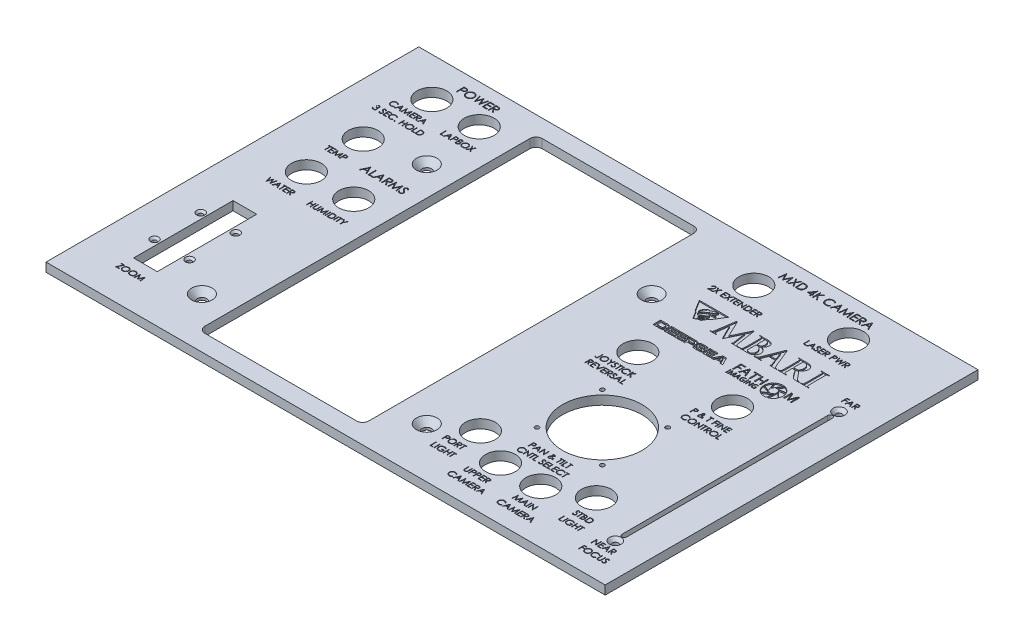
SolidWorks part; units mm, degrees
ref_plane "Front Plane" through (0, 0, 0) normal (0, 0, 1) x (1, 0, 0)
ref_plane "Top Plane" through (0, 0, 0) normal (0, 1, 0) x (1, 0, 0)
ref_plane "Right Plane" through (0, 0, 0) normal (1, 0, 0) x (0, 0, -1)
sketch "Sketch1" plane through (0, 0, 0) normal (0, 1, 0) x (1, 0, 0)
  line L0 (0, 99.9998) -> (0, -99.9998) construction
  line L1 (-149.9997, 99.9998) -> (149.9997, 99.9998)
  line L2 (-149.9997, 99.9998) -> (-149.9997, -99.9998)
  line L3 (-149.9997, -99.9998) -> (149.9997, -99.9998)
  line L4 (149.9997, 99.9998) -> (149.9997, -99.9998)
  line L5 (-149.9997, 99.9998) -> (149.9997, -99.9998) construction
  line L6 (-149.9997, -99.9998) -> (149.9997, 99.9998) construction
  point P0 (0, 0)
  dimension "D1" = 199.9996
  dimension "D2" = 299.9994
extrude "Boss-Extrude1" add sketch "Sketch1" along normal blind 4.7498
sketch "Sketch2" plane through (0, 4.7498, 0) normal (0, 1, 0) x (1, 0, 0)
  line L0 (-149.9997, -99.9998) -> (149.9997, -99.9998) construction
  line L1 (-128.4097, -21.2598) -> (-115.7097, -21.2598)
  line L2 (-128.4097, -21.2598) -> (-128.4097, -74.5998)
  line L3 (-128.4097, -74.5998) -> (-115.7097, -74.5998)
  line L4 (-115.7097, -21.2598) -> (-115.7097, -74.5998)
  line L5 (-74.3077, 90.4998) -> (7.0883, 90.4998)
  line L6 (-77.6097, 87.1978) -> (-77.6097, -87.1982)
  line L7 (-74.3077, -90.5002) -> (7.0883, -90.5002)
  line L8 (10.3903, 87.1978) -> (10.3903, -87.1982)
  line L10 (130.9497, 38.4302) -> (130.9497, -72.0598)
  line L12 (133.4897, 38.4302) -> (133.4897, -72.0598)
  line L13 (-149.9997, 99.9998) -> (-149.9997, -99.9998) construction
  line L14 (50.6603, 79.0702) -> (101.4603, 79.0702) construction
  line L15 (130.9497, 38.4302) -> (133.4897, 38.4302) construction
  line L16 (132.2197, 39.7002) -> (132.2197, 38.4302) construction
  line L17 (132.2197, -72.0598) -> (132.2197, -73.3298) construction
  line L18 (130.9497, -72.0598) -> (133.4897, -72.0598) construction
  line L19 (40.6475, -27.6098) -> (100.4241, -27.6098) construction
  line L20 (76.0603, 97.2552) -> (76.0603, -53.0551) construction
  line L21 (-122.0597, -74.5998) -> (-122.0597, 94.7152) construction
  line L22 (-122.0597, 11.7602) -> (-86.434, 11.7602) construction
  line L23 (50.6603, 16.8402) -> (50.6603, 79.0702) construction
  line L24 (101.4603, 16.8402) -> (101.4603, 79.0702) construction
  line L25 (50.6603, 16.8402) -> (101.4603, 16.8402) construction
  line L26 (-96.6597, -1.4419) -> (-96.6597, 89.1405) construction
  line L27 (-122.0597, 79.0702) -> (-82.6532, 79.0702) construction
  circle A0 centre (76.0603, -27.6098) radius 21.336
  arc A1 (133.4897, 38.4302) -> (130.9497, 38.4302) centre (132.2197, 38.4302) ccw
  arc A2 (130.9497, -72.0598) -> (133.4897, -72.0598) centre (132.2197, -72.0598) ccw
  circle A3 centre (86.8553, -71.4248) radius 8.001
  circle A4 centre (107.1753, -61.8998) radius 8.001
  circle A5 centre (-122.0597, 79.0702) radius 8.001
  circle A6 centre (-122.0597, 42.2402) radius 8.001
  circle A11 centre (101.4603, 16.8402) radius 8.001
  circle A12 centre (50.6603, 16.8402) radius 8.001
  circle A13 centre (50.6603, 79.0702) radius 8.001
  circle A14 centre (101.4603, 79.0702) radius 8.001
  circle A15 centre (-122.0597, 11.7602) radius 8.001
  arc A17 (7.0883, -90.5002) -> (10.3903, -87.1982) centre (7.0883, -87.1982) ccw
  arc A18 (-77.6097, -87.1982) -> (-74.3077, -90.5002) centre (-74.3077, -87.1982) ccw
  arc A19 (7.0883, 90.4998) -> (10.3903, 87.1978) centre (7.0883, 87.1978) cw
  arc A20 (-74.3077, 90.4998) -> (-77.6097, 87.1978) centre (-74.3077, 87.1978) ccw
  circle A21 centre (44.9453, -61.8998) radius 8.001
  circle A22 centre (65.2653, -71.4248) radius 8.001
  circle A23 centre (-96.6597, 11.7602) radius 8.001
  circle A24 centre (-96.6597, 79.0702) radius 8.001
  point P21 (132.2197, -72.6948)
  dimension "D10" = 42.672
  dimension "D13" = 1.27
  dimension "D14" = 1.27
  dimension "D18" = 43.815
  dimension "D20" = 16.002
  dimension "D23" = 16.002
  dimension "D40" = 3.302
  dimension "D48" = 16.002
  dimension "D49" = 16.002
  dimension "D50" = 16.002
  dimension "D51" = 16.002
  dimension "D52" = 16.002
  dimension "D53" = 16.002
  dimension "D54" = 16.002
  dimension "D27" = 16.002
  dimension "D28" = 16.002
  dimension "D1" = 25.4
  dimension "D2" = 21.59
  dimension "D3" = 12.7
  dimension "D4" = 53.34
  dimension "D5" = 181
  dimension "D6" = 88
  dimension "D7" = 9.4996
  dimension "D8" = 72.39
  dimension "D9" = 72.39
  dimension "D11" = 226.06
  dimension "D12" = 2.54
  dimension "D15" = 110.49
  dimension "D16" = 27.94
  dimension "D17" = 282.2194
  dimension "D19" = 10.795
  dimension "D21" = 31.115
  dimension "D22" = 34.29
  dimension "D24" = 116.84
  dimension "D25" = 62.23
  dimension "D26" = 53.34
  dimension "D41" = 111.76
  dimension "D42" = 142.24
  dimension "D43" = 179.07
  dimension "D44" = 25.4
  dimension "D45" = 25.4
extrude "Cut-Extrude1" cut sketch "Sketch2" against normal through all
sketch "Sketch3" plane through (0, 4.7498, 0) normal (0, 1, 0) x (1, 0, 0)
  line L0 (-134.4416, 65.1002) -> (136.4546, 65.1002) construction
  line L1 (-149.9997, -99.9998) -> (149.9997, -99.9998) construction
  line L2 (-141.2326, 27.0002) -> (138.1735, 27.0002) construction
  line L3 (-141.2326, -3.4798) -> (-97.0964, -3.4798) construction
  line L5 (40.7797, 3.1877) -> (120.5059, 3.1877) construction
  line L7 (37.7416, -75.8698) -> (106.4944, -75.8698) construction
  line L9 (55.5395, -84.7598) -> (81.8998, -84.7598) construction
  line L10 (149.9997, -99.9998) -> (149.9997, 99.9998) construction
  line L11 (120.5059, -2.2098) -> (31.7465, -2.2098) construction
  line L13 (40.7797, 3.1877) -> (40.7797, -2.2098) construction
  line L15 (91.8337, 3.1877) -> (91.8337, -2.2098) construction
  text T0 "JOYSTICK  "
  text T1 "HUMIDITY"
  text T2 "  CAMERA  3 SEC. HOLD"
  text T3 "ZOOM"
  text T4 "WATER"
  text T5 "TEMP"
  text T6 "2X EXTENDER"
  text T7 "LASER PWR"
  text T8 "P & T FINE"
  text T9 "FOCUS"
  text T10 "NEAR"
  text T11 "FAR"
  text T12 " STBD  LIGHT"
  text T13 "  MAIN  CAMERA"
  text T14 "  UPPER  CAMERA"
  text T15 "PORT  LIGHT"
  text T16 "PAN & TILT"
  text T17 "MXD 4K CAMERA" font "Century Gothic" height in points 16
  text T18 "ALARMS" font "Century Gothic" height in points 16
  text T19 "LAPBOX"
  text T20 "POWER" font "Century Gothic" height in points 16
  text T21 "REVERSAL"
  text T22 "CONTROL"
  text T23 "CNTL SELECT"
  dimension "D1" = 165.1
  dimension "D2" = 127
  dimension "D3" = 103.1875
  dimension "D4" = 24.13
  dimension "D5" = 15.24
  dimension "D6" = 96.52
  dimension "D7" = 189.23
  dimension "D8" = 43.815
  dimension "D9" = 85.725
  dimension "D10" = 97.79
  dimension "D11" = 38.735
  dimension "D12" = 86.995
  dimension "D13" = 109.22
  dimension "D14" = 58.166
  dimension "D15" = 16.51
extrude "Cut-Extrude2" cut sketch "Sketch3" against normal blind 0.635
hole_wizard "CSK for #10 Flat Head Machine Screw1" positions "Sketch4" profile "Sketch5" countersink size "#10" standard "ANSI Inch"
sketch "Sketch4" plane through (0, 4.7498, 0) normal (0, 1, 0) x (1, 0, 0)
  point P0 (-93.345, 47.625)
  point P3 (-93.345, -73.025)
  point P6 (27.305, -73.025)
  point P9 (27.305, 47.625)
sketch "Sketch5" plane through (-93.345, 4.7498, -47.625) normal (1, 0, 0) x (0, 0, 1)
  line L0 (0, 0) -> (0, 4.7498)
  line L1 (0, 4.7498) -> (2.5527, 4.7498)
  line L2 (2.5527, 4.7498) -> (2.5527, 3.4187)
  line L3 (2.5527, 3.4187) -> (5.5245, 0)
  line L5 (5.5245, 0) -> (0, 0)
  line L6 (-2.5527, 3.4187) -> (-5.5245, 0) construction
  line L11 (0, -6.35) -> (0, 107.95) construction
  dimension "Thru Hole Dia." = 5.1054
  dimension "Thru Hole Depth" = 4.7498
  dimension "Near C'Sink Dia." = 11.049
  dimension "Near C'Sink Angle" = 82
hole_wizard "CSK for #2 Flat Head Machine Screw1" positions "Sketch6" profile "Sketch7" countersink size "#2" standard "ANSI Inch"
sketch "Sketch6" plane through (0, 4.7498, 0) normal (0, 1, 0) x (1, 0, 0)
  line L0 (-131.4577, -35.5346) -> (-131.4577, -60.325) construction
  line L1 (-131.4577, -60.325) -> (-112.6617, -60.325) construction
  line L2 (-112.6617, -60.325) -> (-112.6617, -35.5346) construction
  line L3 (-112.6617, -35.5346) -> (-131.4577, -35.5346) construction
  line L5 (-122.0597, -21.2598) -> (-122.0597, -74.5998) construction
  line L6 (-115.7097, -21.2598) -> (-128.4097, -21.2598) construction
  line L7 (-128.4097, -74.5998) -> (-115.7097, -74.5998) construction
  line L9 (-128.4097, -47.9298) -> (-115.7097, -47.9298) construction
  line L10 (-128.4097, -21.2598) -> (-128.4097, -74.5998) construction
  line L11 (-115.7097, -74.5998) -> (-115.7097, -21.2598) construction
  point P0 (-131.4577, -35.5346)
  point P2 (-112.6617, -35.5346)
  point P4 (-112.6617, -60.325)
  point P6 (-131.4577, -60.325)
  dimension "D1" = 9.398
  dimension "D2" = 18.796
  dimension "D3" = 12.3952
  dimension "D4" = 24.7904
sketch "Sketch7" plane through (-131.4577, 4.7498, 35.5346) normal (1, 0, 0) x (0, 0, 1)
  line L0 (0, 0) -> (0, 4.7498)
  line L1 (0, 4.7498) -> (1.2192, 4.7498)
  line L2 (1.2192, 4.7498) -> (1.2192, 1.1103)
  line L3 (1.2192, 1.1103) -> (2.1844, 0)
  line L5 (2.1844, 0) -> (0, 0)
  line L6 (-1.2192, 1.1103) -> (-2.1844, 0) construction
  line L11 (0, -6.35) -> (0, 107.95) construction
  dimension "Thru Hole Dia." = 2.4384
  dimension "Thru Hole Depth" = 4.7498
  dimension "Near C'Sink Dia." = 4.3688
  dimension "Near C'Sink Angle" = 82
hole_wizard "#4-40 Tapped Hole1" positions "Sketch8" profile "Sketch9" tap size "#4-40" standard "ANSI Inch"
sketch "Sketch8" plane through (0, 4.7498, 0) normal (0, 1, 0) x (1, 0, 0)
  line L0 (58.5343, -10.0838) -> (93.5863, -10.0838) construction
  line L1 (93.5863, -10.0838) -> (93.5863, -45.1358) construction
  line L2 (93.5863, -45.1358) -> (58.5343, -45.1358) construction
  line L3 (58.5343, -45.1358) -> (58.5343, -10.0838) construction
  line L5 (54.7243, -27.6098) -> (97.3963, -27.6098) construction
  line L7 (76.0603, -6.2738) -> (76.0603, -48.9458) construction
  circle A0 centre (76.0603, -27.6098) radius 21.336 construction
  point P0 (58.5343, -10.0838)
  point P2 (93.5863, -10.0838)
  point P4 (93.5863, -45.1358)
  point P6 (58.5343, -45.1358)
  dimension "D1" = 17.526
  dimension "D2" = 35.052
  dimension "D3" = 17.526
  dimension "D4" = 35.052
sketch "Sketch9" plane through (58.5343, 4.7498, 10.0838) normal (1, 0, 0) x (0, 0, 1)
  line L0 (0, 0) -> (0, 4.7498)
  line L1 (0, 4.7498) -> (1.1303, 4.7498)
  line L2 (1.1303, 4.7498) -> (1.1303, 0)
  line L5 (1.1303, 0) -> (0, 0)
  line L11 (0, -6.35) -> (0, 107.95) construction
  dimension "Thread Major Dia." = 2.2606
  dimension "Thru Tap Drill Depth" = 4.7498
hole_wizard "CSK for #4 Flat Head Machine Screw1" positions "Sketch10" profile "Sketch11" countersink size "#4" standard "ANSI Inch"
sketch "Sketch10" plane through (0, 4.7498, 0) normal (0, 1, 0) x (1, 0, 0)
  line L1 (132.2197, 41.692) -> (132.2197, -88.1599) construction
  line L3 (130.9497, -16.8148) -> (133.4897, -16.8148) construction
  line L5 (133.4897, -72.0598) -> (133.4897, 38.4302) construction
  line L6 (130.9497, 38.4302) -> (130.9497, -72.0598) construction
  point P0 (132.2197, 43.1852)
  point P2 (132.2197, -76.8148)
  dimension "D1" = 120
  dimension "D2" = 60
sketch "Sketch11" plane through (132.2197, 4.7498, -43.1852) normal (1, 0, 0) x (0, 0, 1)
  line L0 (0, 0) -> (0, 4.7498)
  line L1 (0, 4.7498) -> (1.6319, 4.7498)
  line L2 (1.6319, 4.7498) -> (1.6319, 1.7751)
  line L3 (1.6319, 1.7751) -> (3.175, 0)
  line L5 (3.175, 0) -> (0, 0)
  line L6 (-1.632, 1.7751) -> (-3.175, 0) construction
  line L11 (0, -6.35) -> (0, 107.95) construction
  dimension "Thru Hole Dia." = 3.2639
  dimension "Thru Hole Depth" = 4.7498
  dimension "Near C'Sink Dia." = 6.35
  dimension "Near C'Sink Angle" = 82
sketch "Sketch12" plane through (0, 4.7498, 0) normal (0, 1, 0) x (1, 0, 0)
  line L0 (63.3963, 57.2737) -> (67.4901, 48.8157)
  line L1 (67.4901, 48.8157) -> (71.5692, 57.3786)
  line L2 (72.1691, 57.2737) -> (73.5339, 48.0058)
  line L3 (71.8089, 47.1363) -> (70.9091, 53.7348)
  line L4 (70.9091, 53.7348) -> (70.849, 53.7348)
  line L5 (70.849, 53.7348) -> (67.5799, 46.9263)
  line L6 (63.216, 53.5696) -> (63.1562, 53.5696)
  line L7 (63.1562, 53.5696) -> (62.3763, 47.6013)
  line L8 (61.2517, 47.5714) -> (62.7364, 57.3485)
  line L9 (78.9197, 51.875) -> (78.9197, 48.3209)
  line L10 (87.6056, 49.8652) -> (86.7955, 47.7209)
  line L11 (87.1705, 46.3411) -> (87.3954, 46.3411)
  line L12 (85.6407, 47.7209) -> (89.4049, 57.1385)
  line L13 (92.4347, 46.7009) -> (91.235, 49.8801)
  line L14 (90.8745, 50.8252) -> (89.5251, 54.5291)
  line L15 (89.3601, 54.5291) -> (87.9801, 50.8403)
  line L16 (107.7837, 46.0713) -> (106.3589, 46.0713)
  line L17 (100.9451, 50.7352) -> (99.6405, 50.7651)
  line L18 (99.5203, 50.6451) -> (99.5203, 50.4351)
  line L19 (111.7344, 53.0598) -> (111.7344, 50.4205)
  line L20 (52.6101, 54.0346) -> (52.6039, 53.9861)
  line L21 (53.9713, 55.9958) -> (54.0382, 55.9587)
  line L256 (43.0063, 57.5156) -> (46.7871, 51.3878)
  line L257 (46.7871, 51.3878) -> (47.2165, 51.3878)
  line L258 (47.2165, 51.3878) -> (50.8633, 45.4987)
  line L259 (50.8633, 45.4987) -> (54.5059, 51.3878)
  line L260 (54.5059, 51.3878) -> (54.9489, 51.3878)
  line L261 (54.9489, 51.3878) -> (58.7301, 57.5156)
  line L262 (58.7301, 57.5156) -> (43.0063, 57.5156)
  line L263 (54.3276, 56.3331) -> (54.2625, 56.2405)
  line L264 (51.0648, 54.2538) -> (50.6373, 53.9216)
  line L265 (52.8742, 54.6344) -> (52.5961, 54.7167)
  line L266 (50.3806, 48.0414) -> (50.988, 48.7734)
  line L267 (51.1383, 54.191) -> (51.3163, 54.2821)
  line L268 (52.8101, 54.5419) -> (54.6636, 54.3981)
  line L269 (54.734, 54.5113) -> (54.8182, 54.4159)
  spline S0 degree 3 poles (62.7364, 57.3485) (62.7812, 57.6035) (62.8712, 57.7385) (62.9912, 57.7385) knots 0 0 0 0 1 1 1 1
  spline S1 degree 3 poles (62.9912, 57.7385) (63.1111, 57.7385) (63.201, 57.6636) (63.3963, 57.2737) knots 1 1 1 1 2 2 2 2
  spline S2 degree 3 poles (71.5692, 57.3786) (71.6743, 57.6186) (71.7641, 57.7385) (71.899, 57.7385) knots 4 4 4 4 5 5 5 5
  spline S3 degree 3 poles (71.899, 57.7385) (72.034, 57.7385) (72.1238, 57.5884) (72.1691, 57.2737) knots 5 5 5 5 6 6 6 6
  spline S4 degree 3 poles (73.5339, 48.0058) (73.6688, 47.0612) (73.8185, 46.6261) (74.2686, 46.4911) knots 7 7 7 7 8 8 8 8
  spline S5 degree 3 poles (74.2686, 46.4911) (74.7033, 46.3562) (75.0033, 46.3414) (75.1982, 46.3414) knots 8 8 8 8 9 9 9 9
  spline S6 degree 3 poles (75.1982, 46.3414) (75.3335, 46.3414) (75.4381, 46.3263) (75.4381, 46.2363) knots 9 9 9 9 10 10 10 10
  spline S7 degree 3 poles (75.4381, 46.2363) (75.4381, 46.1163) (75.2585, 46.0713) (75.0483, 46.0713) knots 10 10 10 10 11 11 11 11
  spline S8 degree 3 poles (75.0483, 46.0713) (74.6735, 46.0713) (72.6037, 46.1163) (72.0039, 46.1615) knots 11 11 11 11 12 12 12 12
  spline S9 degree 3 poles (72.0039, 46.1615) (71.659, 46.1912) (71.569, 46.2363) (71.569, 46.3263) knots 12 12 12 12 13 13 13 13
  spline S10 degree 3 poles (71.569, 46.3263) (71.569, 46.4014) (71.6289, 46.4465) (71.7342, 46.4913) knots 13 13 13 13 14 14 14 14
  spline S11 degree 3 poles (71.7342, 46.4913) (71.8238, 46.5216) (71.869, 46.7163) (71.8089, 47.1363) knots 14 14 14 14 15 15 15 15
  spline S12 degree 3 poles (67.5799, 46.9263) (67.2351, 46.2216) (67.1599, 46.0866) (67.0249, 46.0866) knots 18 18 18 18 19 19 19 19
  spline S13 degree 3 poles (67.0249, 46.0866) (66.89, 46.0866) (66.7399, 46.3866) (66.5002, 46.8363) knots 19 19 19 19 20 20 20 20
  spline S14 degree 3 poles (66.5002, 46.8363) (66.1403, 47.5262) (64.9557, 49.8209) (64.7758, 50.2406) knots 20 20 20 20 21 21 21 21
  spline S15 degree 3 poles (64.7758, 50.2406) (64.6406, 50.5553) (63.7409, 52.4451) (63.216, 53.5696) knots 21 21 21 21 22 22 22 22
  spline S16 degree 3 poles (62.3763, 47.6013) (62.3461, 47.3312) (62.3312, 47.1363) (62.3312, 46.8964) knots 24 24 24 24 25 25 25 25
  spline S17 degree 3 poles (62.3312, 46.8964) (62.3312, 46.6114) (62.526, 46.4764) (62.7812, 46.4165) knots 25 25 25 25 26 26 26 26
  spline S18 degree 3 poles (62.7812, 46.4165) (63.0513, 46.3566) (63.261, 46.3418) (63.411, 46.3418) knots 26 26 26 26 27 27 27 27
  spline S19 degree 3 poles (63.411, 46.3418) (63.5309, 46.3418) (63.636, 46.3116) (63.636, 46.2367) knots 27 27 27 27 28 28 28 28
  spline S20 degree 3 poles (63.636, 46.2367) (63.636, 46.1018) (63.5008, 46.0717) (63.2761, 46.0717) knots 28 28 28 28 29 29 29 29
  spline S21 degree 3 poles (63.2761, 46.0717) (62.6461, 46.0717) (61.9713, 46.1167) (61.7015, 46.1167) knots 29 29 29 29 30 30 30 30
  spline S22 degree 3 poles (61.7015, 46.1167) (61.4167, 46.1167) (60.6969, 46.0717) (60.217, 46.0717) knots 30 30 30 30 31 31 31 31
  spline S23 degree 3 poles (60.217, 46.0717) (60.0669, 46.0717) (59.9468, 46.1018) (59.9468, 46.2367) knots 31 31 31 31 32 32 32 32
  spline S24 degree 3 poles (59.9468, 46.2367) (59.9468, 46.3116) (60.037, 46.3418) (60.1867, 46.3418) knots 32 32 32 32 33 33 33 33
  spline S25 degree 3 poles (60.1867, 46.3418) (60.3067, 46.3418) (60.4118, 46.3418) (60.6368, 46.3868) knots 33 33 33 33 34 34 34 34
  spline S26 degree 3 poles (60.6368, 46.3868) (61.0566, 46.4766) (61.1768, 47.0618) (61.2517, 47.5714) knots 34 34 34 34 35 35 35 35
  spline S28 degree 3 poles (77.0901, 56.239) (77.0601, 56.7487) (76.9401, 56.9888) (76.4452, 57.0937) knots 1 1 1 1 2 2 2 2
  spline S29 degree 3 poles (76.4452, 57.0937) (76.3252, 57.1238) (76.07, 57.1387) (75.8602, 57.1387) knots 2 2 2 2 3 3 3 3
  spline S30 degree 3 poles (75.8602, 57.1387) (75.6952, 57.1387) (75.6056, 57.1684) (75.6056, 57.2737) knots 3 3 3 3 4 4 4 4
  spline S31 degree 3 poles (75.6056, 57.2737) (75.6056, 57.3786) (75.7103, 57.4086) (75.9352, 57.4086) knots 4 4 4 4 5 5 5 5
  spline S32 degree 3 poles (75.9352, 57.4086) (76.7301, 57.4086) (77.675, 57.3638) (77.9746, 57.3638) knots 5 5 5 5 6 6 6 6
  spline S33 degree 3 poles (77.9746, 57.3638) (78.7097, 57.3638) (79.2945, 57.4086) (79.8045, 57.4086) knots 6 6 6 6 7 7 7 7
  spline S34 degree 3 poles (79.8045, 57.4086) (82.5186, 57.4086) (82.9986, 55.9541) (82.9986, 55.1593) knots 7 7 7 7 8 8 8 8
  spline S35 degree 3 poles (82.9986, 55.1593) (82.9986, 53.9293) (82.2937, 53.1946) (81.469, 52.5347) knots 8 8 8 8 9 9 9 9
  spline S36 degree 3 poles (81.469, 52.5347) (82.6988, 52.1149) (84.1983, 51.0498) (84.1983, 49.2953) knots 9 9 9 9 10 10 10 10
  spline S37 degree 3 poles (84.1983, 49.2953) (84.1983, 47.6907) (82.9536, 46.0263) (80.1942, 46.0263) knots 10 10 10 10 11 11 11 11
  spline S38 degree 3 poles (80.1942, 46.0263) (79.8342, 46.0263) (78.4698, 46.1163) (78.0199, 46.1163) knots 11 11 11 11 12 12 12 12
  spline S39 degree 3 poles (78.0199, 46.1163) (77.6748, 46.1163) (76.7299, 46.0713) (76.1303, 46.0713) knots 12 12 12 12 13 13 13 13
  spline S40 degree 3 poles (76.1303, 46.0713) (75.9352, 46.0713) (75.8303, 46.1163) (75.8303, 46.2214) knots 13 13 13 13 14 14 14 14
  spline S41 degree 3 poles (75.8303, 46.2214) (75.8303, 46.2961) (75.8906, 46.3414) (76.0702, 46.3414) knots 14 14 14 14 15 15 15 15
  spline S42 degree 3 poles (76.0702, 46.3414) (76.2953, 46.3414) (76.4751, 46.3713) (76.6102, 46.4014) knots 15 15 15 15 16 16 16 16
  spline S43 degree 3 poles (76.6102, 46.4014) (76.91, 46.4615) (76.9854, 46.7911) (77.045, 47.2259) knots 16 16 16 16 17 17 17 17
  spline S44 degree 3 poles (77.045, 47.2259) (77.2231, 49.0065) (77.1617, 52.3479) (77.0901, 56.239) knots 17 17 17 17 18 18 18 18
  spline S46 degree 3 poles (78.9197, 52.8048) (78.9197, 52.6848) (78.9647, 52.6547) (79.0248, 52.64) knots 0 0 0 0 1 1 1 1
  spline S47 degree 3 poles (79.0248, 52.64) (79.1597, 52.6096) (79.3847, 52.5948) (79.7293, 52.5948) knots 1 1 1 1 2 2 2 2
  spline S48 degree 3 poles (79.7293, 52.5948) (80.2245, 52.5948) (80.554, 52.6549) (80.8093, 52.8799) knots 2 2 2 2 3 3 3 3
  spline S49 degree 3 poles (80.8093, 52.8799) (81.1991, 53.1946) (81.4244, 53.7348) (81.4244, 54.4695) knots 3 3 3 3 4 4 4 4
  spline S50 degree 3 poles (81.4244, 54.4695) (81.4244, 55.4742) (80.8394, 56.7941) (79.5497, 56.7941) knots 4 4 4 4 5 5 5 5
  spline S51 degree 3 poles (79.5497, 56.7941) (79.3397, 56.7941) (79.2049, 56.7941) (79.0548, 56.7639) knots 5 5 5 5 6 6 6 6
  spline S52 degree 3 poles (79.0548, 56.7639) (78.9499, 56.7338) (78.9197, 56.6741) (78.9197, 56.5089) knots 6 6 6 6 7 7 7 7
  spline S53 degree 2 poles (78.9197, 56.5089) (78.9197, 52.8048) (78.9197, 52.8048) knots 7 7 7 8 8 8
  spline S54 degree 3 poles (80.8993, 51.6051) (80.5844, 51.83) (80.2396, 51.9348) (79.6546, 51.965) knots 0 0 0 0 1 1 1 1
  spline S55 degree 3 poles (79.6546, 51.965) (79.3847, 51.9801) (79.2346, 51.9801) (79.0098, 51.9801) knots 1 1 1 1 2 2 2 2
  spline S56 degree 3 poles (79.0098, 51.9801) (78.9497, 51.9801) (78.9197, 51.9497) (78.9197, 51.875) knots 2 2 2 2 3 3 3 3
  spline S57 degree 3 poles (78.9197, 48.3209) (78.9197, 47.331) (78.9647, 47.0762) (79.4448, 46.8813) knots 4 4 4 4 5 5 5 5
  spline S58 degree 3 poles (79.4448, 46.8813) (79.8497, 46.7163) (80.1944, 46.7015) (80.5394, 46.7015) knots 5 5 5 5 6 6 6 6
  spline S59 degree 3 poles (80.5394, 46.7015) (81.2144, 46.7015) (82.354, 47.0614) (82.354, 48.6209) knots 6 6 6 6 7 7 7 7
  spline S60 degree 3 poles (82.354, 48.6209) (82.3538, 49.5503) (82.0391, 50.8099) (80.8993, 51.6051) knots 7 7 7 7 8 8 8 8
  spline S61 degree 3 poles (87.7404, 49.9852) (87.6655, 49.9852) (87.6351, 49.9553) (87.6056, 49.8652) knots 0 0 0 0 1 1 1 1
  spline S62 degree 3 poles (86.7955, 47.7209) (86.6458, 47.3457) (86.5711, 46.9858) (86.5711, 46.8059) knots 2 2 2 2 3 3 3 3
  spline S63 degree 3 poles (86.5711, 46.8059) (86.5711, 46.5359) (86.7057, 46.3411) (87.1705, 46.3411) knots 3 3 3 3 4 4 4 4
  spline S64 degree 3 poles (87.3954, 46.3411) (87.5752, 46.3411) (87.6205, 46.311) (87.6205, 46.2212) knots 5 5 5 5 6 6 6 6
  spline S65 degree 3 poles (87.6205, 46.2212) (87.6205, 46.1012) (87.5306, 46.0711) (87.3654, 46.0711) knots 6 6 6 6 7 7 7 7
  spline S66 degree 3 poles (87.3654, 46.0711) (86.8858, 46.0711) (86.2405, 46.1161) (85.7755, 46.1161) knots 7 7 7 7 8 8 8 8
  spline S67 degree 3 poles (85.7755, 46.1161) (85.6107, 46.1161) (84.7858, 46.0711) (84.0061, 46.0711) knots 8 8 8 8 9 9 9 9
  spline S68 degree 3 poles (84.0061, 46.0711) (83.811, 46.0711) (83.7212, 46.1012) (83.7212, 46.2212) knots 9 9 9 9 10 10 10 10
  spline S69 degree 3 poles (83.7212, 46.2212) (83.7212, 46.311) (83.7813, 46.3411) (83.9012, 46.3411) knots 10 10 10 10 11 11 11 11
  spline S70 degree 3 poles (83.9012, 46.3411) (84.0361, 46.3411) (84.2461, 46.356) (84.3662, 46.3711) knots 11 11 11 11 12 12 12 12
  spline S71 degree 3 poles (84.3662, 46.3711) (85.0559, 46.4613) (85.3409, 46.9709) (85.6407, 47.7209) knots 12 12 12 12 13 13 13 13
  spline S72 degree 3 poles (89.4049, 57.1385) (89.5852, 57.5733) (89.675, 57.7383) (89.8251, 57.7383) knots 14 14 14 14 15 15 15 15
  spline S73 degree 3 poles (89.8251, 57.7383) (89.9599, 57.7383) (90.0502, 57.6033) (90.1999, 57.2585) knots 15 15 15 15 16 16 16 16
  spline S74 degree 3 poles (90.1999, 57.2585) (90.56, 56.4335) (92.9591, 50.315) (93.9191, 48.0354) knots 16 16 16 16 17 17 17 17
  spline S75 degree 3 poles (93.9191, 48.0354) (94.4894, 46.686) (94.9239, 46.4758) (95.2388, 46.401) knots 17 17 17 17 18 18 18 18
  spline S76 degree 3 poles (95.2388, 46.401) (95.4638, 46.356) (95.6887, 46.3409) (95.8683, 46.3409) knots 18 18 18 18 19 19 19 19
  spline S77 degree 3 poles (95.8683, 46.3409) (95.9883, 46.3409) (96.0637, 46.3259) (96.0637, 46.221) knots 19 19 19 19 20 20 20 20
  spline S78 degree 3 poles (96.0637, 46.221) (96.0637, 46.101) (95.929, 46.0709) (95.3738, 46.0709) knots 20 20 20 20 21 21 21 21
  spline S79 degree 3 poles (95.3738, 46.0709) (94.8336, 46.0709) (93.739, 46.0709) (92.5398, 46.101) knots 21 21 21 21 22 22 22 22
  spline S80 degree 3 poles (92.5398, 46.101) (92.2693, 46.1159) (92.0899, 46.1159) (92.0899, 46.221) knots 22 22 22 22 23 23 23 23
  spline S81 degree 3 poles (92.0899, 46.221) (92.0899, 46.3108) (92.1493, 46.3409) (92.2996, 46.3558) knots 23 23 23 23 24 24 24 24
  spline S82 degree 3 poles (92.2996, 46.3558) (92.4048, 46.386) (92.5096, 46.521) (92.4347, 46.7009) knots 24 24 24 24 25 25 25 25
  spline S83 degree 3 poles (91.235, 49.8801) (91.2051, 49.9549) (91.1605, 49.9848) (91.0853, 49.9848) knots 26 26 26 26 27 27 27 27
  spline S84 degree 2 poles (91.0853, 49.9848) (87.7404, 49.9848) (87.7404, 49.9852) knots 27 27 27 28 28 28
  spline S85 degree 3 poles (90.7995, 50.7352) (90.8745, 50.7352) (90.8902, 50.7804) (90.8745, 50.8252) knots 0 0 0 0 1 1 1 1
  spline S86 degree 3 poles (89.5251, 54.5291) (89.5098, 54.5892) (89.4947, 54.6644) (89.4503, 54.6644) knots 2 2 2 2 3 3 3 3
  spline S87 degree 3 poles (89.4503, 54.6644) (89.4049, 54.6644) (89.3752, 54.5894) (89.3601, 54.5291) knots 3 3 3 3 4 4 4 4
  spline S88 degree 3 poles (87.9801, 50.8403) (87.9655, 50.7804) (87.9801, 50.7354) (88.0402, 50.7354) knots 5 5 5 5 6 6 6 6
  spline S89 degree 2 poles (88.0402, 50.7354) (90.7995, 50.7354) (90.7995, 50.7352) knots 6 6 6 7 7 7
  spline S90 degree 3 poles (97.7505, 53.0598) (97.7505, 55.3392) (97.7505, 55.759) (97.721, 56.239) knots 0 0 0 0 1 1 1 1
  spline S91 degree 3 poles (97.721, 56.239) (97.6911, 56.7487) (97.5711, 56.9888) (97.0759, 57.0937) knots 1 1 1 1 2 2 2 2
  spline S92 degree 3 poles (97.0759, 57.0937) (96.956, 57.1238) (96.701, 57.1387) (96.4914, 57.1387) knots 2 2 2 2 3 3 3 3
  spline S93 degree 3 poles (96.4914, 57.1387) (96.3264, 57.1387) (96.236, 57.1684) (96.236, 57.2737) knots 3 3 3 3 4 4 4 4
  spline S94 degree 3 poles (96.236, 57.2737) (96.236, 57.3786) (96.3413, 57.4086) (96.5661, 57.4086) knots 4 4 4 4 5 5 5 5
  spline S95 degree 3 poles (96.5661, 57.4086) (97.3609, 57.4086) (98.3058, 57.3638) (98.6205, 57.3638) knots 5 5 5 5 6 6 6 6
  spline S96 degree 3 poles (98.6205, 57.3638) (99.1309, 57.3638) (100.2699, 57.4086) (100.7351, 57.4086) knots 6 6 6 6 7 7 7 7
  spline S97 degree 3 poles (100.7351, 57.4086) (101.6802, 57.4086) (102.6849, 57.3188) (103.4948, 56.7637) knots 7 7 7 7 8 8 8 8
  spline S98 degree 3 poles (103.4948, 56.7637) (103.9143, 56.4788) (104.5142, 55.7139) (104.5142, 54.7092) knots 8 8 8 8 9 9 9 9
  spline S99 degree 3 poles (104.5142, 54.7092) (104.5142, 53.5997) (104.0498, 52.5799) (102.5348, 51.3501) knots 9 9 9 9 10 10 10 10
  spline S100 degree 3 poles (102.5348, 51.3501) (103.8695, 49.6705) (104.9044, 48.336) (105.7888, 47.4062) knots 10 10 10 10 11 11 11 11
  spline S101 degree 3 poles (105.7888, 47.4062) (106.6288, 46.5363) (107.2439, 46.4312) (107.4686, 46.3864) knots 11 11 11 11 12 12 12 12
  spline S102 degree 3 poles (107.4686, 46.3864) (107.6334, 46.3562) (107.7688, 46.3414) (107.8886, 46.3414) knots 12 12 12 12 13 13 13 13
  spline S103 degree 3 poles (107.8886, 46.3414) (108.0087, 46.3414) (108.0682, 46.2963) (108.0682, 46.2214) knots 13 13 13 13 14 14 14 14
  spline S104 degree 3 poles (108.0682, 46.2214) (108.0682, 46.1014) (107.9635, 46.0713) (107.7837, 46.0713) knots 14 14 14 14 15 15 15 15
  spline S105 degree 3 poles (106.3589, 46.0713) (105.5191, 46.0713) (105.1442, 46.1464) (104.7541, 46.3562) knots 16 16 16 16 17 17 17 17
  spline S106 degree 3 poles (104.7541, 46.3562) (104.1091, 46.7013) (103.5394, 47.406) (102.6996, 48.5609) knots 17 17 17 17 18 18 18 18
  spline S107 degree 3 poles (102.6996, 48.5609) (102.0999, 49.3856) (101.4101, 50.4052) (101.215, 50.6301) knots 18 18 18 18 19 19 19 19
  spline S108 degree 3 poles (101.215, 50.6301) (101.14, 50.7203) (101.0504, 50.7352) (100.9451, 50.7352) knots 19 19 19 19 20 20 20 20
  spline S109 degree 3 poles (99.6405, 50.7651) (99.5658, 50.7651) (99.5203, 50.7352) (99.5203, 50.6451) knots 21 21 21 21 22 22 22 22
  spline S110 degree 3 poles (99.5203, 50.4351) (99.5203, 49.0405) (99.5203, 47.8557) (99.5955, 47.2257) knots 23 23 23 23 24 24 24 24
  spline S111 degree 3 poles (99.5955, 47.2257) (99.6405, 46.7909) (99.7307, 46.4611) (100.1803, 46.4012) knots 24 24 24 24 25 25 25 25
  spline S112 degree 3 poles (100.1803, 46.4012) (100.4053, 46.3711) (100.7349, 46.3412) (100.9151, 46.3412) knots 25 25 25 25 26 26 26 26
  spline S113 degree 3 poles (100.9151, 46.3412) (101.0349, 46.3412) (101.0948, 46.2961) (101.0948, 46.2212) knots 26 26 26 26 27 27 27 27
  spline S114 degree 3 poles (101.0948, 46.2212) (101.0948, 46.1161) (100.9899, 46.0711) (100.795, 46.0711) knots 27 27 27 27 28 28 28 28
  spline S115 degree 3 poles (100.795, 46.0711) (99.9255, 46.0711) (98.8152, 46.1161) (98.5903, 46.1161) knots 28 28 28 28 29 29 29 29
  spline S116 degree 3 poles (98.5903, 46.1161) (98.3058, 46.1161) (97.3609, 46.0711) (96.7611, 46.0711) knots 29 29 29 29 30 30 30 30
  spline S117 degree 3 poles (96.7611, 46.0711) (96.5661, 46.0711) (96.4608, 46.1161) (96.4608, 46.2212) knots 30 30 30 30 31 31 31 31
  spline S118 degree 3 poles (96.4608, 46.2212) (96.4608, 46.2959) (96.5209, 46.3412) (96.7008, 46.3412) knots 31 31 31 31 32 32 32 32
  spline S119 degree 3 poles (96.7008, 46.3412) (96.9258, 46.3412) (97.1061, 46.3711) (97.2407, 46.4012) knots 32 32 32 32 33 33 33 33
  spline S120 degree 3 poles (97.2407, 46.4012) (97.541, 46.4613) (97.6155, 46.7909) (97.6754, 47.2257) knots 33 33 33 33 34 34 34 34
  spline S121 degree 3 poles (97.6754, 47.2257) (97.7501, 47.8557) (97.7501, 49.0405) (97.7501, 50.4203) knots 34 34 34 34 35 35 35 35
  spline S122 degree 2 poles (97.7501, 50.4203) (97.7501, 53.0598) (97.7505, 53.0598) knots 35 35 35 36 36 36
  spline S123 degree 3 poles (99.5203, 51.8748) (99.5203, 51.7098) (99.55, 51.6497) (99.6554, 51.6049) knots 0 0 0 0 1 1 1 1
  spline S124 degree 3 poles (99.6554, 51.6049) (99.9707, 51.5) (100.4202, 51.4548) (100.7952, 51.4548) knots 1 1 1 1 2 2 2 2
  spline S125 degree 3 poles (100.7952, 51.4548) (101.395, 51.4548) (101.5897, 51.5146) (101.86, 51.7096) knots 2 2 2 2 3 3 3 3
  spline S126 degree 3 poles (101.86, 51.7096) (102.3093, 52.0397) (102.745, 52.7294) (102.745, 53.9592) knots 3 3 3 3 4 4 4 4
  spline S127 degree 3 poles (102.745, 53.9592) (102.745, 56.0883) (101.3353, 56.7034) (100.4507, 56.7034) knots 4 4 4 4 5 5 5 5
  spline S128 degree 3 poles (100.4507, 56.7034) (100.0756, 56.7034) (99.8055, 56.6884) (99.6554, 56.6433) knots 5 5 5 5 6 6 6 6
  spline S129 degree 3 poles (99.6554, 56.6433) (99.55, 56.6134) (99.5203, 56.5535) (99.5203, 56.4335) knots 6 6 6 6 7 7 7 7
  spline S130 degree 2 poles (99.5203, 56.4335) (99.5203, 51.8748) (99.5203, 51.8748) knots 7 7 7 8 8 8
  spline S131 degree 3 poles (109.8742, 53.0598) (109.8742, 55.3392) (109.8742, 55.759) (109.8445, 56.239) knots 0 0 0 0 1 1 1 1
  spline S132 degree 3 poles (109.8445, 56.239) (109.815, 56.7487) (109.6646, 57.0039) (109.3349, 57.0788) knots 1 1 1 1 2 2 2 2
  spline S133 degree 3 poles (109.3349, 57.0788) (109.1697, 57.1236) (108.975, 57.1387) (108.7947, 57.1387) knots 2 2 2 2 3 3 3 3
  spline S134 degree 3 poles (108.7947, 57.1387) (108.645, 57.1387) (108.5548, 57.1684) (108.5548, 57.2886) knots 3 3 3 3 4 4 4 4
  spline S135 degree 3 poles (108.5548, 57.2886) (108.5548, 57.3786) (108.6747, 57.4086) (108.9147, 57.4086) knots 4 4 4 4 5 5 5 5
  spline S136 degree 3 poles (108.9147, 57.4086) (109.4848, 57.4086) (110.4297, 57.3638) (110.8645, 57.3638) knots 5 5 5 5 6 6 6 6
  spline S137 degree 3 poles (110.8645, 57.3638) (111.2393, 57.3638) (112.1243, 57.4086) (112.6944, 57.4086) knots 6 6 6 6 7 7 7 7
  spline S138 degree 3 poles (112.6944, 57.4086) (112.8891, 57.4086) (113.0089, 57.3786) (113.0089, 57.2886) knots 7 7 7 7 8 8 8 8
  spline S139 degree 3 poles (113.0089, 57.2886) (113.0089, 57.1684) (112.9188, 57.1387) (112.7691, 57.1387) knots 8 8 8 8 9 9 9 9
  spline S140 degree 3 poles (112.7691, 57.1387) (112.619, 57.1387) (112.499, 57.1236) (112.319, 57.0937) knots 9 9 9 9 10 10 10 10
  spline S141 degree 3 poles (112.319, 57.0937) (111.9138, 57.0189) (111.7939, 56.7637) (111.7644, 56.239) knots 10 10 10 10 11 11 11 11
  spline S142 degree 3 poles (111.7644, 56.239) (111.7344, 55.7592) (111.7344, 55.3392) (111.7344, 53.0598) knots 11 11 11 11 12 12 12 12
  spline S143 degree 3 poles (111.7344, 50.4205) (111.7344, 48.9658) (111.7344, 47.7812) (111.7939, 47.1361) knots 13 13 13 13 14 14 14 14
  spline S144 degree 3 poles (111.7939, 47.1361) (111.8391, 46.7312) (111.944, 46.4613) (112.3937, 46.4014) knots 14 14 14 14 15 15 15 15
  spline S145 degree 3 poles (112.3937, 46.4014) (112.6039, 46.3713) (112.9341, 46.3414) (113.1585, 46.3414) knots 15 15 15 15 16 16 16 16
  spline S146 degree 3 poles (113.1585, 46.3414) (113.3237, 46.3414) (113.3985, 46.2963) (113.3985, 46.2214) knots 16 16 16 16 17 17 17 17
  spline S147 degree 3 poles (113.3985, 46.2214) (113.3985, 46.1163) (113.2787, 46.0713) (113.1133, 46.0713) knots 17 17 17 17 18 18 18 18
  spline S148 degree 3 poles (113.1133, 46.0713) (112.1238, 46.0713) (111.1792, 46.1163) (110.7745, 46.1163) knots 18 18 18 18 19 19 19 19
  spline S149 degree 3 poles (110.7745, 46.1163) (110.4296, 46.1163) (109.4845, 46.0713) (108.8847, 46.0713) knots 19 19 19 19 20 20 20 20
  spline S150 degree 3 poles (108.8847, 46.0713) (108.6898, 46.0713) (108.5847, 46.1163) (108.5847, 46.2214) knots 20 20 20 20 21 21 21 21
  spline S151 degree 3 poles (108.5847, 46.2214) (108.5847, 46.2961) (108.645, 46.3414) (108.8246, 46.3414) knots 21 21 21 21 22 22 22 22
  spline S152 degree 3 poles (108.8246, 46.3414) (109.0499, 46.3414) (109.2297, 46.3713) (109.3646, 46.4014) knots 22 22 22 22 23 23 23 23
  spline S153 degree 3 poles (109.3646, 46.4014) (109.6644, 46.4615) (109.754, 46.7163) (109.7992, 47.151) knots 23 23 23 23 24 24 24 24
  spline S154 degree 3 poles (109.7992, 47.151) (109.8738, 47.7812) (109.8738, 48.9658) (109.8738, 50.4205) knots 24 24 24 24 25 25 25 25
  spline S155 degree 2 poles (109.8738, 50.4205) (109.8738, 53.0598) (109.8742, 53.0598) knots 25 25 25 26 26 26
  spline S365 degree 3 poles (53.863, 56.3358) (53.8412, 56.3502) (53.7994, 56.3502) (53.7673, 56.3502) (53.7016, 56.3502) (53.6469, 56.309) (53.6469, 56.264) (53.6469, 56.2194) (53.7016, 56.1865) (53.7673, 56.1865) knots 2 2 2 2 3 3 3 4 4 4 5 5 5 5
  spline S366 degree 3 poles (53.8915, 56.2702) (53.8915, 56.2933) (53.8856, 56.3213) (53.863, 56.3358) knots 1 1 1 1 2 2 2 2
  spline S367 degree 3 poles (53.7673, 56.1865) (53.8333, 56.1865) (53.8913, 56.2259) (53.8915, 56.2702) knots 0 0 0 0 1 1 1 1
  spline S368 degree 3 poles (48.7337, 54.7268) (49.0507, 55.1365) (49.7812, 55.8084) (50.7105, 55.5814) knots 0 0 0 0 1 1 1 1
  spline S369 degree 2 poles (50.7105, 55.5814) (49.8019, 55.1528) (49.1277, 54.3583) knots 1 1 1 2 2 2
  spline S370 degree 3 poles (49.1277, 54.3583) (48.9024, 54.0926) (48.6179, 53.6927) (48.454, 53.3542) knots 2 2 2 2 3 3 3 3
  spline S371 degree 3 poles (48.454, 53.3542) (48.454, 53.3542) (48.0602, 52.6295) (48.1364, 51.854) knots 3 3 3 3 4 4 4 4
  spline S372 degree 2 poles (48.1364, 51.854) (47.305, 52.881) (48.7337, 54.7268) knots 4 4 4 5 5 5
  spline S373 degree 2 poles (48.2892, 51.863) (48.3396, 53.4176) (49.6744, 54.625) knots 0 0 0 1 1 1
  spline S374 degree 2 poles (49.6744, 54.625) (51.0541, 56.0037) (53.6214, 56.5286) knots 1 1 1 2 2 2
  spline S375 degree 2 poles (53.6214, 56.5286) (53.6857, 56.5504) (54.0833, 56.5068) knots 2 2 2 3 3 3
  spline S376 degree 2 poles (54.0833, 56.5068) (54.1689, 56.5108) (54.1974, 56.5068) knots 3 3 3 4 4 4
  spline S377 degree 2 poles (54.1974, 56.5068) (54.3688, 56.483) (54.3276, 56.3331) knots 4 4 4 5 5 5
  spline S378 degree 3 poles (54.2625, 56.2405) (54.2566, 56.295) (54.1823, 56.3079) (54.1318, 56.2732) knots 6 6 6 6 7 7 7 7
  spline S379 degree 2 poles (54.1318, 56.2732) (54.0944, 56.2472) (54.0343, 56.1813) knots 7 7 7 8 8 8
  spline S380 degree 2 poles (54.0343, 56.1813) (53.7481, 55.8337) (53.6869, 55.8121) knots 8 8 8 9 9 9
  spline S381 degree 2 poles (53.6869, 55.8121) (53.1604, 55.3777) (51.0648, 54.2538) knots 9 9 9 10 10 10
  spline S382 degree 2 poles (50.6373, 53.9216) (50.5085, 53.555) (49.9891, 53.4463) knots 11 11 11 12 12 12
  spline S383 degree 3 poles (49.9891, 53.4463) (49.6147, 53.1766) (49.5178, 52.9026) (49.4797, 52.7738) knots 12 12 12 12 13 13 13 13
  spline S384 degree 2 poles (49.4797, 52.7738) (49.3875, 52.4602) (49.0984, 52.202) knots 13 13 13 14 14 14
  spline S385 degree 2 poles (49.0984, 52.202) (48.9661, 52.0931) (48.8019, 51.9372) knots 14 14 14 15 15 15
  spline S386 degree 2 poles (48.8019, 51.9372) (48.3013, 51.3457) (49.084, 50.803) knots 15 15 15 16 16 16
  spline S387 degree 3 poles (49.084, 50.803) (48.4031, 50.8754) (48.2783, 51.532) (48.2892, 51.863) knots 16 16 16 16 17 17 17 17
  spline S389 degree 2 poles (54.0382, 55.9587) (53.9762, 55.847) (53.8708, 55.6513) knots 1.34521 1.34521 1.34521 2 2 2
  spline S390 degree 2 poles (53.8708, 55.6513) (53.6335, 55.1411) (52.8742, 54.6344) knots 2 2 2 3 3 3
  spline S391 degree 3 poles (52.5961, 54.7167) (52.7033, 54.7588) (53.2429, 55.1162) (53.4198, 55.2728) knots 4 4 4 4 5 5 5 5
  spline S392 degree 3 poles (53.4198, 55.2728) (53.5578, 55.3949) (53.8134, 55.7625) (53.9256, 55.9313) knots 5 5 5 5 6 6 6 6
  spline S393 degree 2 poles (53.9256, 55.9313) (53.9474, 55.9641) (53.9713, 55.9958) knots 6 6 6 6.216847 6.216847 6.216847
  spline S394 degree 2 poles (49.2908, 46.1468) (48.7311, 46.5264) (48.8729, 46.8566) knots 0 0 0 1 1 1
  spline S395 degree 3 poles (48.8729, 46.8566) (49.0079, 46.8771) (49.0894, 46.8985) (49.1557, 46.9284) knots 1 1 1 1 2 2 2 2
  spline S396 degree 3 poles (49.1557, 46.9284) (49.3609, 47.0214) (49.7669, 47.3404) (49.971, 47.4707) knots 2 2 2 2 3 3 3 3
  spline S397 degree 3 poles (49.971, 47.4707) (50.2166, 47.6277) (50.7331, 47.9842) (50.9843, 48.126) knots 3 3 3 3 4 4 4 4
  spline S398 degree 2 poles (50.9843, 48.126) (51.9996, 48.698) (52.6511, 48.5292) knots 4 4 4 5 5 5
  spline S399 degree 2 poles (52.6511, 48.5292) (53.4275, 48.3245) (53.3194, 48.0651) knots 5 5 5 6 6 6
  spline S400 degree 2 poles (53.3194, 48.0651) (53.1568, 48.3299) (52.6754, 48.2273) knots 6 6 6 7 7 7
  spline S401 degree 2 poles (52.6754, 48.2273) (52.086, 48.113) (51.3093, 47.4403) knots 7 7 7 8 8 8
  spline S402 degree 2 poles (51.3093, 47.4403) (49.6189, 45.9963) (49.2908, 46.1468) knots 8 8 8 9 9 9
  spline S403 degree 3 poles (52.6797, 49.9632) (52.6476, 49.8062) (52.5967, 49.6873) (52.1897, 49.301) knots 0 0 0 0 1 1 1 1
  spline S404 degree 3 poles (52.1897, 49.301) (51.7863, 48.9181) (51.2068, 48.4549) (50.3806, 48.0414) knots 1 1 1 1 2 2 2 2
  spline S405 degree 3 poles (50.988, 48.7734) (51.1651, 48.934) (51.6401, 49.3332) (51.7251, 49.4138) knots 3 3 3 3 4 4 4 4
  spline S406 degree 3 poles (51.7251, 49.4138) (52.0055, 49.6808) (52.3752, 49.9563) (52.487, 50.3621) knots 4 4 4 4 5 5 5 5
  spline S407 degree 2 poles (52.487, 50.3621) (52.5873, 50.3713) (52.6512, 50.2676) knots 5 5 5 6 6 6
  spline S408 degree 3 poles (52.6512, 50.2676) (52.6885, 50.2073) (52.7092, 50.1085) (52.6797, 49.9632) knots 6 6 6 6 7 7 7 7
  spline S409 degree 3 poles (52.058, 50.3742) (51.6948, 50.1517) (51.4523, 49.859) (51.2405, 49.6676) knots 0 0 0 0 1 1 1 1
  spline S410 degree 3 poles (51.2405, 49.6676) (50.9561, 49.4107) (50.7604, 49.4046) (50.608, 49.4291) knots 1 1 1 1 2 2 2 2
  spline S411 degree 2 poles (50.608, 49.4291) (50.4124, 49.4601) (50.3944, 49.6827) knots 2 2 2 3 3 3
  spline S412 degree 3 poles (50.3944, 49.6827) (50.4505, 49.6504) (50.5514, 49.7109) (50.5874, 49.735) knots 3 3 3 3 4 4 4 4
  spline S413 degree 3 poles (50.5874, 49.735) (50.765, 49.8533) (51.1391, 50.1579) (51.3326, 50.2988) knots 4 4 4 4 5 5 5 5
  spline S414 degree 3 poles (51.3326, 50.2988) (51.508, 50.4266) (51.7195, 50.579) (51.8399, 50.633) knots 5 5 5 5 6 6 6 6
  spline S415 degree 3 poles (51.8399, 50.633) (52.1098, 50.7538) (52.2823, 50.7249) (52.4238, 50.6935) knots 6 6 6 6 7 7 7 7
  spline S416 degree 2 poles (52.4238, 50.6935) (52.6413, 50.6451) (52.718, 50.4012) knots 7 7 7 8 8 8
  spline S417 degree 3 poles (52.718, 50.4012) (52.5731, 50.565) (52.1912, 50.4561) (52.058, 50.3742) knots 8 8 8 8 9 9 9 9
  spline S418 degree 3 poles (52.5555, 51.6244) (52.0057, 51.2217) (50.8366, 50.4942) (50.623, 50.3051) knots 0 0 0 0 1 1 1 1
  spline S419 degree 3 poles (50.623, 50.3051) (50.5301, 50.2224) (50.0043, 49.7733) (50.3157, 49.472) knots 1 1 1 1 2 2 2 2
  spline S420 degree 2 poles (50.3157, 49.472) (50.099, 49.5556) (50.0242, 49.8173) knots 2 2 2 3 3 3
  spline S421 degree 3 poles (50.0242, 49.8173) (49.9579, 50.0501) (49.9231, 50.2926) (50.3515, 50.7754) knots 3 3 3 3 4 4 4 4
  spline S422 degree 3 poles (50.3515, 50.7754) (50.6147, 51.072) (51.3562, 51.6086) (51.7846, 51.8658) knots 4 4 4 4 5 5 5 5
  spline S423 degree 3 poles (51.7846, 51.8658) (52.0482, 52.0238) (52.4002, 52.2786) (52.548, 52.4576) knots 5 5 5 5 6 6 6 6
  spline S424 degree 3 poles (52.548, 52.4576) (52.6093, 52.5326) (52.7575, 52.663) (52.7337, 52.8642) knots 6 6 6 6 7 7 7 7
  spline S425 degree 2 poles (52.7337, 52.8642) (53.1501, 52.9649) (53.3032, 52.63) knots 7 7 7 8 8 8
  spline S426 degree 2 poles (53.3032, 52.63) (53.2759, 52.1524) (52.5555, 51.6244) knots 8 8 8 9 9 9
  spline S427 degree 2 poles (54.9436, 54.3713) (54.9055, 54.334) (54.7999, 54.2842) knots 0 0 0 1 1 1
  spline S428 degree 2 poles (54.7999, 54.2842) (54.2839, 54.0168) (53.152, 53.9174) knots 1 1 1 2 2 2
  spline S429 degree 2 poles (53.152, 53.9174) (51.6531, 53.7869) (51.1383, 54.191) knots 2 2 2 3 3 3
  spline S430 degree 2 poles (51.3163, 54.2821) (51.86, 53.998) (52.6039, 53.9861) knots 4 4 4 4.77139 4.77139 4.77139
  spline S431 degree 2 poles (52.6101, 54.0346) (52.0325, 54.1088) (51.6272, 54.3541) knots 5.270569 5.270569 5.270569 6 6 6
  spline S432 degree 2 poles (51.6272, 54.3541) (51.9025, 54.4427) (51.994, 54.4734) knots 6 6 6 7 7 7
  spline S433 degree 2 poles (51.994, 54.4734) (52.1648, 54.531) (52.3907, 54.6319) knots 7 7 7 8 8 8
  spline S434 degree 3 poles (52.3907, 54.6319) (52.4184, 54.6464) (52.4251, 54.6416) (52.4357, 54.638) knots 8 8 8 8 9 9 9 9
  spline S435 degree 3 poles (52.4357, 54.638) (52.5551, 54.5986) (52.6305, 54.5794) (52.8101, 54.5419) knots 9 9 9 9 10 10 10 10
  spline S436 degree 2 poles (54.6636, 54.3981) (54.7084, 54.4684) (54.734, 54.5113) knots 11 11 11 12 12 12
  spline S437 degree 2 poles (54.8182, 54.4159) (54.8613, 54.4372) (54.8929, 54.5429) knots 13 13 13 14 14 14
  spline S438 degree 2 poles (54.8929, 54.5429) (54.9203, 54.4883) (54.9341, 54.4586) knots 14 14 14 15 15 15
  spline S439 degree 3 poles (54.9341, 54.4586) (54.9413, 54.4427) (54.9586, 54.4035) (54.9436, 54.3713) knots 15 15 15 15 16 16 16 16
extrude "Cut-Extrude9" cut sketch "Sketch12" against normal blind 0.635
sketch "Sketch14" plane through (0, 4.7498, 0) normal (0, 1, 0) x (1, 0, 0)
  line L0 (41.8178, 33.8303) -> (41.8178, 37.9188)
  line L1 (41.8178, 37.9188) -> (44.7682, 37.9188)
  line L2 (44.7712, 33.8303) -> (41.8178, 33.8303)
  line L3 (43.0459, 34.8726) -> (44.7801, 34.8726)
  line L4 (44.7682, 36.8975) -> (43.0459, 36.8975)
  line L5 (43.0459, 36.8975) -> (43.0459, 34.8726)
  line L6 (47.7095, 37.9188) -> (52.2384, 37.9188)
  line L7 (52.2384, 37.9188) -> (52.2384, 36.9574)
  line L8 (52.2384, 36.9574) -> (48.9376, 36.9574)
  line L9 (48.9376, 36.9574) -> (48.9376, 36.3673)
  line L10 (48.9376, 36.3673) -> (52.0706, 36.3673)
  line L11 (52.0706, 36.3673) -> (52.0706, 35.4687)
  line L12 (52.0706, 35.4687) -> (48.9376, 35.4687)
  line L13 (48.9376, 35.4687) -> (48.9376, 34.8127)
  line L14 (48.9376, 34.8127) -> (52.2623, 34.8127)
  line L15 (52.2623, 34.8127) -> (52.2623, 33.8303)
  line L16 (52.2623, 33.8303) -> (47.7095, 33.8303)
  line L17 (47.7095, 33.8303) -> (47.7095, 37.9188)
  line L18 (52.6517, 37.9188) -> (57.1806, 37.9188)
  line L19 (57.1806, 37.9188) -> (57.1806, 36.9574)
  line L20 (57.1806, 36.9574) -> (53.8798, 36.9574)
  line L21 (53.8798, 36.9574) -> (53.8798, 36.3673)
  line L22 (53.8798, 36.3673) -> (57.0128, 36.3673)
  line L23 (57.0128, 36.3673) -> (57.0128, 35.4687)
  line L24 (57.0128, 35.4687) -> (53.8798, 35.4687)
  line L25 (53.8798, 35.4687) -> (53.8798, 34.8127)
  line L26 (53.8798, 34.8127) -> (57.2045, 34.8127)
  line L27 (57.2045, 34.8127) -> (57.2045, 33.8303)
  line L28 (57.2045, 33.8303) -> (52.6517, 33.8303)
  line L29 (52.6517, 33.8303) -> (52.6517, 37.9188)
  line L30 (57.5939, 33.8303) -> (57.5939, 37.9188)
  line L31 (57.5939, 37.9188) -> (60.3945, 37.9188)
  line L32 (60.4064, 34.8307) -> (58.84, 34.8307)
  line L33 (58.84, 34.8307) -> (58.84, 33.8303)
  line L34 (58.84, 33.8303) -> (57.5939, 33.8303)
  line L35 (58.84, 35.8521) -> (60.3975, 35.8521)
  line L36 (60.3975, 36.8975) -> (58.84, 36.8975)
  line L37 (58.84, 36.8975) -> (58.84, 35.8521)
  line L38 (62.7697, 35.1841) -> (63.9768, 35.1841)
  line L39 (67.6251, 36.6339) -> (66.418, 36.6339)
  line L40 (62.7697, 34.9924) -> (62.7697, 35.1841)
  line L41 (68.2062, 37.9188) -> (72.735, 37.9188)
  line L42 (72.735, 37.9188) -> (72.735, 36.9574)
  line L43 (72.735, 36.9574) -> (69.4342, 36.9574)
  line L44 (69.4342, 36.9574) -> (69.4342, 36.3673)
  line L45 (69.4342, 36.3673) -> (72.5673, 36.3673)
  line L46 (72.5673, 36.3673) -> (72.5673, 35.4687)
  line L47 (72.5673, 35.4687) -> (69.4342, 35.4687)
  line L48 (69.4342, 35.4687) -> (69.4342, 34.8127)
  line L49 (69.4342, 34.8127) -> (72.759, 34.8127)
  line L50 (72.759, 34.8127) -> (72.759, 33.8303)
  line L51 (72.759, 33.8303) -> (68.2062, 33.8303)
  line L52 (68.2062, 33.8303) -> (68.2062, 37.9188)
  line L53 (77.8414, 33.8303) -> (77.491, 34.5222)
  line L54 (77.491, 34.5222) -> (74.7862, 34.5222)
  line L55 (74.7862, 34.5222) -> (74.4358, 33.8303)
  line L56 (74.4358, 33.8303) -> (73.013, 33.8303)
  line L57 (73.013, 33.8303) -> (75.1816, 37.9188)
  line L58 (75.1816, 37.9188) -> (77.1165, 37.9188)
  line L59 (77.1165, 37.9188) -> (79.2551, 33.8303)
  line L60 (79.2551, 33.8303) -> (77.8414, 33.8303)
  line L61 (77.0536, 35.4178) -> (76.2658, 36.9663)
  line L62 (76.2658, 36.9663) -> (76.0173, 36.9663)
  line L63 (76.0173, 36.9663) -> (75.2295, 35.4178)
  line L64 (75.2295, 35.4178) -> (77.0536, 35.4178)
  spline S0 degree 3 poles (44.7682, 37.9188) (45.2913, 37.9188) (45.6338, 37.9149) (45.7955, 37.9068) knots 2 2 2 2 3 3 3 3
  spline S1 degree 3 poles (45.7955, 37.9068) (45.9573, 37.8989) (46.126, 37.8769) (46.3017, 37.841) knots 3 3 3 3 4 4 4 4
  spline S2 degree 3 poles (46.3017, 37.841) (46.7111, 37.7571) (46.9777, 37.5255) (47.1015, 37.146) knots 4 4 4 4 5 5 5 5
  spline S3 degree 3 poles (47.1015, 37.146) (47.1474, 37.0023) (47.1783, 36.848) (47.1943, 36.6833) knots 5 5 5 5 6 6 6 6
  spline S4 degree 3 poles (47.1943, 36.6833) (47.2103, 36.5186) (47.2183, 36.2694) (47.2183, 35.936) knots 6 6 6 6 7 7 7 7
  spline S5 degree 3 poles (47.2183, 35.936) (47.2183, 35.5705) (47.2088, 35.294) (47.1898, 35.1063) knots 7 7 7 7 8 8 8 8
  spline S6 degree 3 poles (47.1898, 35.1063) (47.1708, 34.9185) (47.1354, 34.7478) (47.0835, 34.5941) knots 8 8 8 8 9 9 9 9
  spline S7 degree 3 poles (47.0835, 34.5941) (46.9617, 34.2346) (46.7111, 34.013) (46.3317, 33.9291) knots 9 9 9 9 10 10 10 10
  spline S8 degree 3 poles (46.3317, 33.9291) (46.154, 33.8892) (45.9643, 33.8627) (45.7626, 33.8498) knots 10 10 10 10 11 11 11 11
  spline S9 degree 3 poles (45.7626, 33.8498) (45.5609, 33.8368) (45.2304, 33.8303) (44.7712, 33.8303) knots 11 11 11 11 12 12 12 12
  spline S10 degree 3 poles (44.7801, 34.8726) (45.0996, 34.8726) (45.3348, 34.8831) (45.4855, 34.9041) knots 1 1 1 1 2 2 2 2
  spline S11 degree 3 poles (45.4855, 34.9041) (45.6363, 34.9251) (45.7426, 34.9615) (45.8045, 35.0134) knots 2 2 2 2 3 3 3 3
  spline S12 degree 3 poles (45.8045, 35.0134) (45.8724, 35.0713) (45.9203, 35.1632) (45.9483, 35.289) knots 3 3 3 3 4 4 4 4
  spline S13 degree 3 poles (45.9483, 35.289) (45.9763, 35.4148) (45.9902, 35.6045) (45.9902, 35.8581) knots 4 4 4 4 5 5 5 5
  spline S14 degree 3 poles (45.9902, 35.8581) (45.9902, 36.1117) (45.9782, 36.3024) (45.9543, 36.4302) knots 5 5 5 5 6 6 6 6
  spline S15 degree 3 poles (45.9543, 36.4302) (45.9303, 36.558) (45.8884, 36.6558) (45.8285, 36.7237) knots 6 6 6 6 7 7 7 7
  spline S16 degree 3 poles (45.8285, 36.7237) (45.7606, 36.7976) (45.6622, 36.845) (45.5335, 36.866) knots 7 7 7 7 8 8 8 8
  spline S17 degree 3 poles (45.5335, 36.866) (45.4046, 36.887) (45.1496, 36.8975) (44.7682, 36.8975) knots 8 8 8 8 9 9 9 9
  spline S18 degree 3 poles (60.3945, 37.9188) (60.9496, 37.9188) (61.307, 37.9078) (61.4668, 37.8859) knots 2 2 2 2 3 3 3 3
  spline S19 degree 3 poles (61.4668, 37.8859) (61.8722, 37.832) (62.1462, 37.7017) (62.2891, 37.495) knots 3 3 3 3 4 4 4 4
  spline S20 degree 3 poles (62.2891, 37.495) (62.4317, 37.2883) (62.5032, 36.9194) (62.5032, 36.3883) knots 4 4 4 4 5 5 5 5
  spline S21 degree 3 poles (62.5032, 36.3883) (62.5032, 35.8831) (62.4442, 35.5286) (62.3265, 35.3249) knots 5 5 5 5 6 6 6 6
  spline S22 degree 3 poles (62.3265, 35.3249) (62.2465, 35.1872) (62.1347, 35.0823) (61.991, 35.0104) knots 6 6 6 6 7 7 7 7
  spline S23 degree 3 poles (61.991, 35.0104) (61.8472, 34.9386) (61.6505, 34.8886) (61.4009, 34.8607) knots 7 7 7 7 8 8 8 8
  spline S24 degree 3 poles (61.4009, 34.8607) (61.2232, 34.8407) (60.8917, 34.8307) (60.4064, 34.8307) knots 8 8 8 8 9 9 9 9
  spline S25 degree 3 poles (60.3975, 35.8521) (60.6811, 35.8541) (60.8543, 35.8581) (60.9172, 35.8641) knots 1 1 1 1 2 2 2 2
  spline S26 degree 3 poles (60.9172, 35.8641) (60.9801, 35.8701) (61.0364, 35.886) (61.0864, 35.912) knots 2 2 2 2 3 3 3 3
  spline S27 degree 3 poles (61.0864, 35.912) (61.1503, 35.9459) (61.1942, 35.9974) (61.2182, 36.0663) knots 3 3 3 3 4 4 4 4
  spline S28 degree 3 poles (61.2182, 36.0663) (61.2422, 36.1351) (61.2541, 36.2425) (61.2541, 36.3883) knots 4 4 4 4 5 5 5 5
  spline S29 degree 3 poles (61.2541, 36.3883) (61.2541, 36.534) (61.2392, 36.6408) (61.2092, 36.7088) knots 5 5 5 5 6 6 6 6
  spline S30 degree 3 poles (61.2092, 36.7088) (61.1793, 36.7766) (61.1263, 36.8255) (61.0505, 36.8555) knots 6 6 6 6 7 7 7 7
  spline S31 degree 3 poles (61.0505, 36.8555) (60.9946, 36.8775) (60.7769, 36.8914) (60.3975, 36.8975) knots 7 7 7 7 8 8 8 8
  spline S32 degree 3 poles (63.9768, 35.1841) (63.9749, 34.9825) (64.0158, 34.8527) (64.0996, 34.7948) knots 1 1 1 1 2 2 2 2
  spline S33 degree 3 poles (64.0996, 34.7948) (64.1595, 34.7568) (64.2369, 34.7343) (64.3318, 34.7274) knots 2 2 2 2 3 3 3 3
  spline S34 degree 3 poles (64.3318, 34.7274) (64.4266, 34.7204) (64.7257, 34.7149) (65.2289, 34.7109) knots 3 3 3 3 4 4 4 4
  spline S35 degree 3 poles (65.2289, 34.7109) (65.7561, 34.7129) (66.0725, 34.7164) (66.1784, 34.7214) knots 4 4 4 4 5 5 5 5
  spline S36 degree 3 poles (66.1784, 34.7214) (66.2842, 34.7264) (66.3681, 34.7419) (66.43, 34.7678) knots 5 5 5 5 6 6 6 6
  spline S37 degree 3 poles (66.43, 34.7678) (66.5218, 34.8058) (66.5678, 34.9086) (66.5678, 35.0763) knots 6 6 6 6 7 7 7 7
  spline S38 degree 3 poles (66.5678, 35.0763) (66.5678, 35.1981) (66.5353, 35.2795) (66.4704, 35.3204) knots 7 7 7 7 8 8 8 8
  spline S39 degree 3 poles (66.4704, 35.3204) (66.4055, 35.3614) (66.2732, 35.3838) (66.0735, 35.3878) knots 8 8 8 8 9 9 9 9
  spline S40 degree 3 poles (66.0735, 35.3878) (65.9197, 35.3878) (65.5943, 35.3998) (65.0971, 35.4238) knots 9 9 9 9 10 10 10 10
  spline S41 degree 3 poles (65.0971, 35.4238) (64.5879, 35.4478) (64.2564, 35.4617) (64.1027, 35.4657) knots 10 10 10 10 11 11 11 11
  spline S42 degree 3 poles (64.1027, 35.4657) (63.8031, 35.4757) (63.5729, 35.5041) (63.4123, 35.5511) knots 11 11 11 11 12 12 12 12
  spline S43 degree 3 poles (63.4123, 35.5511) (63.2515, 35.598) (63.1262, 35.6744) (63.0363, 35.7802) knots 12 12 12 12 13 13 13 13
  spline S44 degree 3 poles (63.0363, 35.7802) (62.8826, 35.9559) (62.8057, 36.2495) (62.8057, 36.6608) knots 13 13 13 13 14 14 14 14
  spline S45 degree 3 poles (62.8057, 36.6608) (62.8057, 37.1221) (62.8936, 37.4476) (63.0693, 37.6373) knots 14 14 14 14 15 15 15 15
  spline S46 degree 3 poles (63.0693, 37.6373) (63.2031, 37.785) (63.4087, 37.8794) (63.6863, 37.9203) knots 15 15 15 15 16 16 16 16
  spline S47 degree 3 poles (63.6863, 37.9203) (63.9639, 37.9612) (64.528, 37.9817) (65.3786, 37.9817) knots 16 16 16 16 17 17 17 17
  spline S48 degree 3 poles (65.3786, 37.9817) (65.9797, 37.9817) (66.402, 37.9648) (66.6457, 37.9308) knots 17 17 17 17 18 18 18 18
  spline S49 degree 3 poles (66.6457, 37.9308) (67.021, 37.8789) (67.2786, 37.7746) (67.4185, 37.6178) knots 18 18 18 18 19 19 19 19
  spline S50 degree 3 poles (67.4185, 37.6178) (67.5582, 37.461) (67.6281, 37.197) (67.6281, 36.8255) knots 19 19 19 19 20 20 20 20
  spline S51 degree 3 poles (67.6281, 36.8255) (67.6281, 36.7916) (67.6271, 36.7277) (67.6251, 36.6339) knots 20 20 20 20 21 21 21 21
  spline S52 degree 3 poles (66.418, 36.6339) (66.414, 36.7477) (66.4045, 36.8255) (66.3895, 36.8675) knots 22 22 22 22 23 23 23 23
  spline S53 degree 3 poles (66.3895, 36.8675) (66.3746, 36.9094) (66.3451, 36.9434) (66.3011, 36.9693) knots 23 23 23 23 24 24 24 24
  spline S54 degree 3 poles (66.3011, 36.9693) (66.2473, 37.0013) (66.1524, 37.0217) (66.0167, 37.0307) knots 24 24 24 24 25 25 25 25
  spline S55 degree 3 poles (66.0167, 37.0307) (65.8808, 37.0397) (65.5933, 37.0442) (65.154, 37.0442) knots 25 25 25 25 26 26 26 26
  spline S56 degree 3 poles (65.154, 37.0442) (64.6249, 37.0442) (64.3023, 37.0278) (64.1865, 36.9948) knots 26 26 26 26 27 27 27 27
  spline S57 degree 3 poles (64.1865, 36.9948) (64.0707, 36.9618) (64.0128, 36.8705) (64.0128, 36.7207) knots 27 27 27 27 28 28 28 28
  spline S58 degree 3 poles (64.0128, 36.7207) (64.0128, 36.577) (64.0707, 36.4891) (64.1865, 36.4571) knots 28 28 28 28 29 29 29 29
  spline S59 degree 3 poles (64.1865, 36.4571) (64.2824, 36.4312) (64.7227, 36.4062) (65.5074, 36.3823) knots 29 29 29 29 30 30 30 30
  spline S60 degree 3 poles (65.5074, 36.3823) (66.1684, 36.3623) (66.6102, 36.3388) (66.8329, 36.3119) knots 30 30 30 30 31 31 31 31
  spline S61 degree 3 poles (66.8329, 36.3119) (67.0555, 36.2849) (67.2327, 36.2335) (67.3645, 36.1576) knots 31 31 31 31 32 32 32 32
  spline S62 degree 3 poles (67.3645, 36.1576) (67.5143, 36.0678) (67.6201, 35.9445) (67.682, 35.7877) knots 32 32 32 32 33 33 33 33
  spline S63 degree 3 poles (67.682, 35.7877) (67.7439, 35.6309) (67.7748, 35.4058) (67.7748, 35.1123) knots 33 33 33 33 34 34 34 34
  spline S64 degree 3 poles (67.7748, 35.1123) (67.7748, 34.7269) (67.7229, 34.4403) (67.6191, 34.2527) knots 34 34 34 34 35 35 35 35
  spline S65 degree 3 poles (67.6191, 34.2527) (67.5412, 34.1148) (67.4329, 34.012) (67.2941, 33.9441) knots 35 35 35 35 36 36 36 36
  spline S66 degree 3 poles (67.2941, 33.9441) (67.1553, 33.8762) (66.9601, 33.8303) (66.7085, 33.8064) knots 36 36 36 36 37 37 37 37
  spline S67 degree 3 poles (66.7085, 33.8064) (66.439, 33.7824) (65.9368, 33.7704) (65.2019, 33.7704) knots 37 37 37 37 38 38 38 38
  spline S68 degree 3 poles (65.2019, 33.7704) (64.5869, 33.7704) (64.1326, 33.7863) (63.839, 33.8183) knots 38 38 38 38 39 39 39 39
  spline S69 degree 3 poles (63.839, 33.8183) (63.5455, 33.8503) (63.3249, 33.9071) (63.1771, 33.989) knots 39 39 39 39 40 40 40 40
  spline S70 degree 3 poles (63.1771, 33.989) (63.0234, 34.0769) (62.917, 34.1928) (62.8581, 34.3365) knots 40 40 40 40 41 41 41 41
  spline S71 degree 3 poles (62.8581, 34.3365) (62.7993, 34.4803) (62.7697, 34.6989) (62.7697, 34.9924) knots 41 41 41 41 42 42 42 42
extrude "Cut-Extrude12" cut sketch "Sketch14" against normal blind 0.635
sketch "Sketch16" plane through (0, 4.7498, 0) normal (0, 1, 0) x (1, 0, 0)
  text T0 "FATH        M" font "Corbel" height in points 17
  text T1 "IMAGING" font "Corbel" height in points 10
extrude "Cut-Extrude13" cut sketch "Sketch16" against normal blind 0.635
sketch "Sketch17" plane through (0, 4.7498, 0) normal (0, 1, 0) x (1, 0, 0)
  line L0 (103.1762, 34.7591) -> (101.5595, 39.1394)
  line L1 (101.771, 39.3181) -> (103.1055, 35.7022)
  line L2 (103.363, 36.3581) -> (105.7797, 40.3532)
  line L3 (106.0513, 40.2992) -> (104.0564, 37.0014)
  line L4 (104.7297, 37.209) -> (109.3599, 37.8105)
  line L5 (109.4871, 37.5645) -> (105.6649, 37.068)
  line L6 (106.247, 36.671) -> (109.6042, 33.4259)
  line L7 (109.4911, 33.1732) -> (106.7199, 35.8519)
  line L8 (106.7725, 35.1493) -> (106.3285, 30.5013)
  line L9 (106.0604, 30.4321) -> (106.4269, 34.2689)
  line L10 (105.9103, 33.7897) -> (101.9996, 31.2388)
  line L11 (101.7783, 31.4052) -> (105.0066, 33.511)
  line L12 (104.3098, 33.616) -> (99.8772, 35.0831)
  line L13 (99.8693, 35.3599) -> (103.5284, 34.1488)
  arc A0 (105.7797, 40.3532) -> (101.771, 39.3181) centre (104.9298, 35.3646) ccw
  arc A1 (103.363, 36.3581) -> (103.1055, 35.7022) centre (104.9298, 35.3646) ccw
  arc A2 (104.7297, 37.209) -> (104.0564, 37.0014) centre (104.9298, 35.3646) ccw
  arc A3 (106.247, 36.671) -> (105.6649, 37.068) centre (104.9298, 35.3646) ccw
  arc A4 (106.7725, 35.1493) -> (106.7199, 35.8519) centre (104.9298, 35.3646) ccw
  arc A5 (105.9103, 33.7897) -> (106.4269, 34.2689) centre (104.9298, 35.3646) ccw
  arc A6 (104.3098, 33.616) -> (105.0066, 33.511) centre (104.9298, 35.3646) ccw
  arc A7 (103.1762, 34.7591) -> (103.5284, 34.1488) centre (104.9298, 35.3646) ccw
  arc A8 (101.5595, 39.1394) -> (99.8693, 35.3599) centre (104.9298, 35.3646) ccw
  arc A9 (99.8772, 35.0831) -> (101.7783, 31.4052) centre (104.9298, 35.3646) ccw
  arc A10 (101.9996, 31.2388) -> (106.0604, 30.4321) centre (104.9298, 35.3646) ccw
  arc A11 (106.3285, 30.5013) -> (109.4911, 33.1732) centre (104.9298, 35.3646) ccw
  arc A12 (109.6042, 33.4259) -> (109.4871, 37.5645) centre (104.9298, 35.3646) ccw
  arc A13 (109.3599, 37.8105) -> (106.0513, 40.2992) centre (104.9298, 35.3646) ccw
  point P33 (104.9298, 35.3646)
  dimension "D1" = 7
extrude "Cut-Extrude14" cut sketch "Sketch17" against normal blind 0.635
sketch "Sketch18" plane through (0, 4.7498, 0) normal (0, 1, 0) x (1, 0, 0)
  line L1 (51.8033, -3.3528) -> (100.3173, -3.3528) construction
  line L2 (51.8033, -3.3528) -> (51.8033, -51.8668) construction
  line L3 (51.8033, -51.8668) -> (100.3173, -51.8668) construction
  line L4 (100.3173, -3.3528) -> (100.3173, -51.8668) construction
  line L5 (51.8033, -3.3528) -> (100.3173, -51.8668) construction
  line L6 (51.8033, -51.8668) -> (100.3173, -3.3528) construction
  point P0 (76.0603, -27.6098)
  dimension "D1" = 48.514
  dimension "D2" = 48.514
